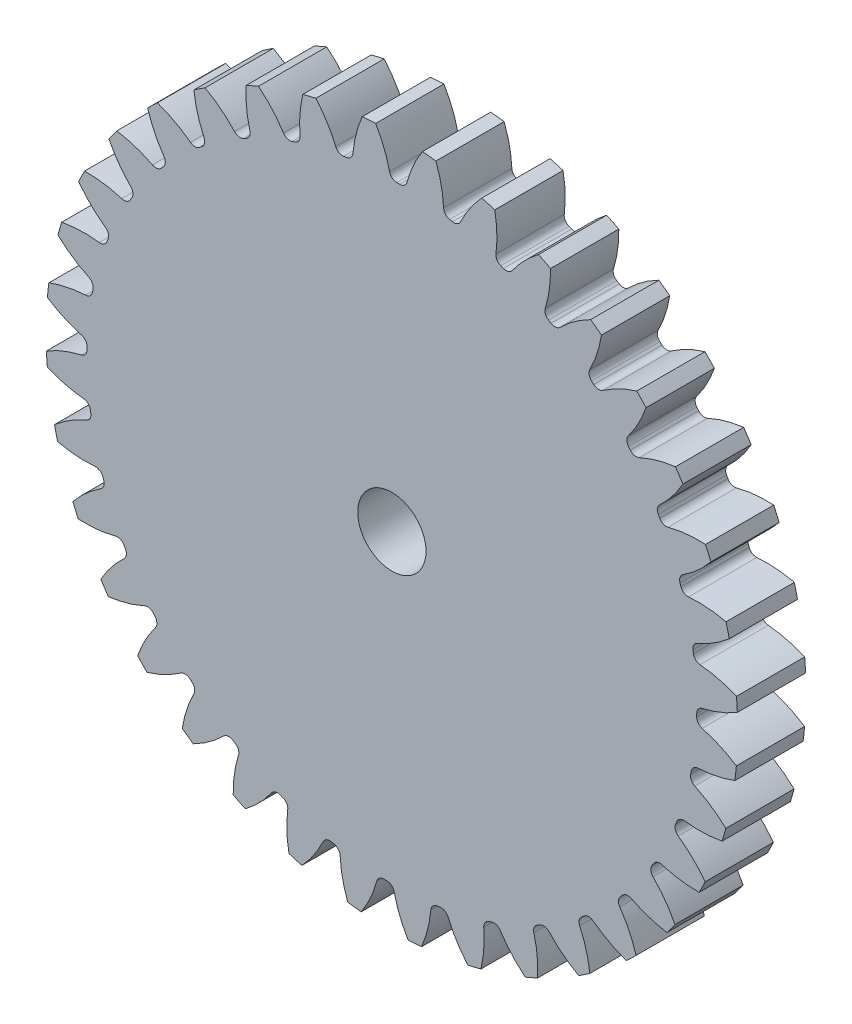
SolidWorks part; units mm, degrees
ref_plane "Front" through (0, 0, 0) normal (0, 0, 1) x (1, 0, 0)
ref_plane "Top" through (0, 0, 0) normal (0, 1, 0) x (1, 0, 0)
ref_plane "Right" through (0, 0, 0) normal (1, 0, 0) x (0, 0, -1)
sketch "Sketch3" plane through (0, 0, 0) normal (0, 0, 1) x (1, 0, 0)
  circle A0 centre (0, 0) radius 643.4667
  dimension "od" = 1286.9333
extrude "gearBody" add sketch "Sketch3" along normal blind 127
sketch "Sketch2" plane through (0, 0, 0) normal (0, 0, 1) x (1, 0, 0)
  line L0 (0, 0) -> (529.232, 219.2151) construction
  line L1 (641.6366, -57.3494) -> (0, 0) construction
  line L2 (0, 0) -> (36.3143, 0) construction
  line L3 (609.4433, 13.8216) -> (608.3411, -39.1575) construction
  line L5 (608.8922, -12.668) -> (0, 0) construction
  line L7 (0, 0) -> (572.8366, 0) construction
  arc A0 (572.8284, 3.0677) -> (572.2051, -26.8901) centre (0, 0) ccw construction
  arc A1 (642.7583, 30.1856) -> (640.9466, -56.8931) centre (0, 0) ccw construction
  arc A2 (609.4433, 13.8216) -> (608.3411, -39.1575) centre (0, 0) ccw construction
  arc A3 (567.0804, -14.5355) -> (567.1943, -9.063) centre (0, 0) ccw
  arc A4 (641.6366, -57.3494) -> (577.2588, -28.1938) centre (519.6565, -241.0372) ccw
  arc A5 (641.6366, -57.3494) -> (643.4667, 30.6129) centre (0, 0) ccw
  arc A6 (643.4667, 30.6129) -> (577.9319, 4.1601) centre (529.232, 219.2151) cw
  arc A7 (567.1943, -9.063) -> (577.9319, 4.1601) centre (580.9762, -9.2833) cw
  arc A8 (577.2588, -28.1938) -> (567.0804, -14.5355) centre (580.8596, -14.8887) cw
  point P6 (643.4667, 30.6129)
  point P22 (641.6366, -57.3494)
  dimension "baseDia" = 1145.6732
  dimension "od" = 1286.9333
  dimension "pd" = 1219.2
  dimension "rd" = 1134.5333
  dimension "rFillet" = 13.7837
  dimension "pointX" = 643.4667
  dimension "pointY" = 30.6129
  dimension "CTT" = 52.9791
  dimension "flankCenterAngle" = 22.5
extrude "toothCut" cut sketch "Sketch2" along normal through all
pattern_circular "CirPattern1" count 36 over 360 about axis through (0, 0, 0) along (0, 0, 1) of "toothCut"
sketch "hub1Dia" plane through (0, 0, 0) normal (0, 0, -1) x (-1, 0, 0)
  circle A0 centre (0, 0) radius 12.7
  dimension "hub1Dia" = 25.4
sketch "hub2Dia" plane through (0, 0, 127) normal (0, 0, 1) x (1, 0, 0)
  circle A0 centre (0, 0) radius 12.7
  dimension "hub2dia" = 25.4
sketch "boreDia" plane through (0, 0, 0) normal (0, 0, 1) x (1, 0, 0)
  circle A0 centre (0, 0) radius 63.5
  dimension "boreDia" = 127
extrude "bore" cut sketch "boreDia" against normal mid plane 25400
